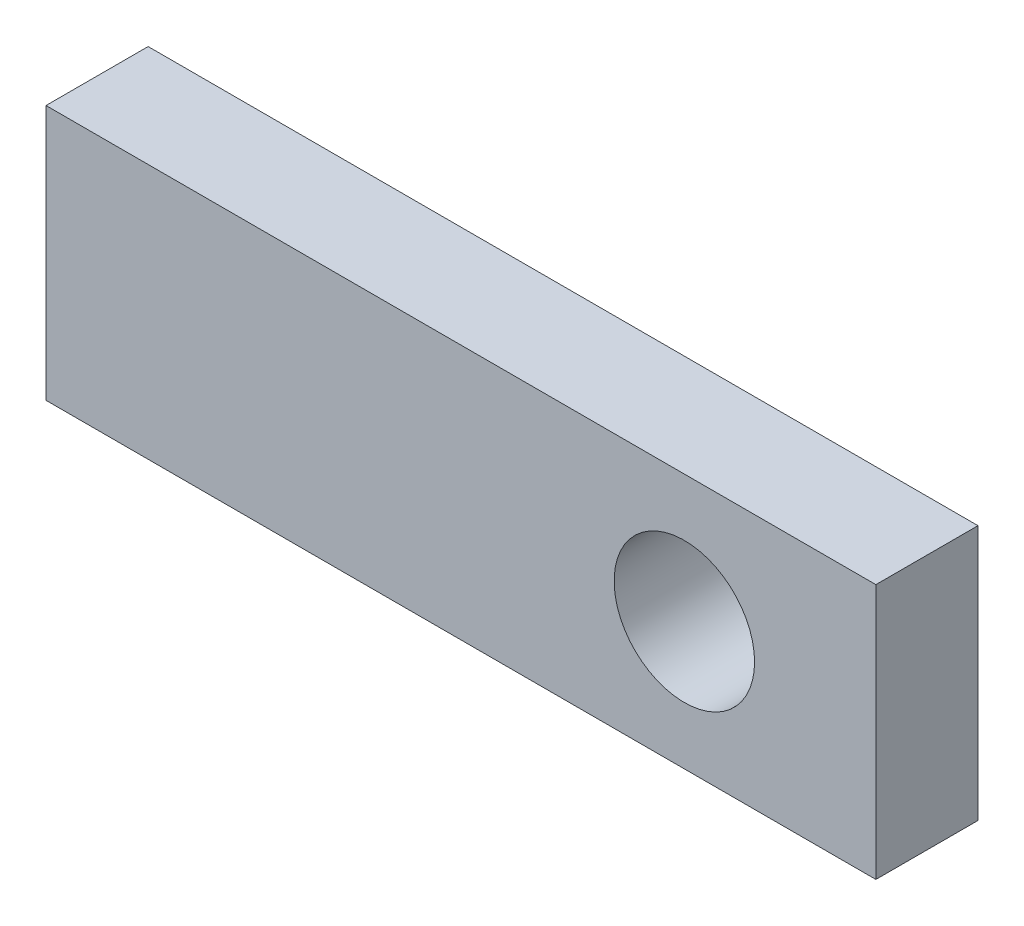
SolidWorks part; units mm, degrees
ref_plane "Plan de face" through (0, 0, 0) normal (0, 0, 1) x (1, 0, 0)
ref_plane "Plan de dessus" through (0, 0, 0) normal (0, 1, 0) x (1, 0, 0)
ref_plane "Plan de droite" through (0, 0, 0) normal (1, 0, 0) x (0, 0, -1)
sketch "Esquisse1" plane through (0, 0, 0) normal (0, 0, 1) x (1, 0, 0)
  line L1 (0, 0) -> (65, 0)
  line L2 (0, 0) -> (0, 20)
  line L3 (0, 20) -> (65, 20)
  line L4 (65, 0) -> (65, 20)
  dimension "D1" = 20
  dimension "D2" = 65
extrude "Extrusion1" add sketch "Esquisse1" along normal blind 8
sketch "Esquisse2" plane through (0, 0, 8) normal (0, 0, 1) x (1, 0, 0)
  line L0 (65, 0) -> (65, 20) construction
  line L1 (0, 0) -> (65, 0) construction
  circle A0 centre (50, 10) radius 5.5
  dimension "D1" = 11
  dimension "D2" = 15
  dimension "D3" = 10
extrude "Enlèv. mat.-Extru.1" cut sketch "Esquisse2" against normal blind 8
